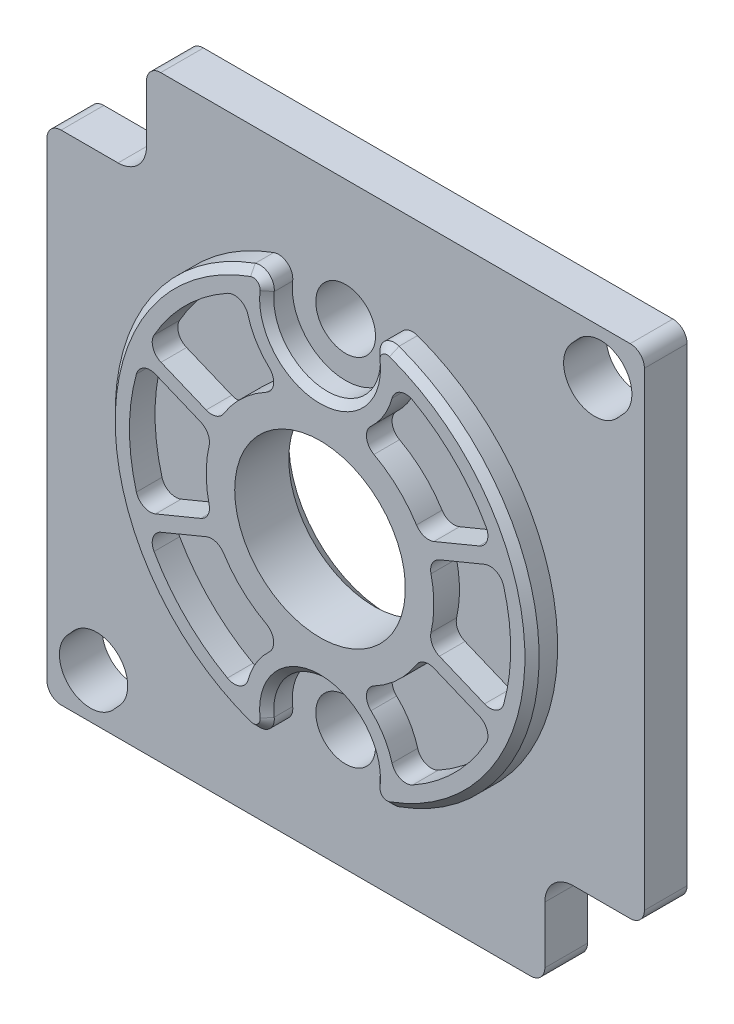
SolidWorks part; units mm, degrees
other "<217-2822-003 Rev4>-<Imported1>"
ref_plane "Front Plane" through (0, 0, 0) normal (0, 0, 1) x (1, 0, 0)
ref_plane "Top Plane" through (0, 0, 0) normal (0, 1, 0) x (1, 0, 0)
ref_plane "Right Plane" through (0, 0, 0) normal (1, 0, 0) x (0, 0, -1)
mirrored part "217-2822-003 Rev4_Mirrored"
